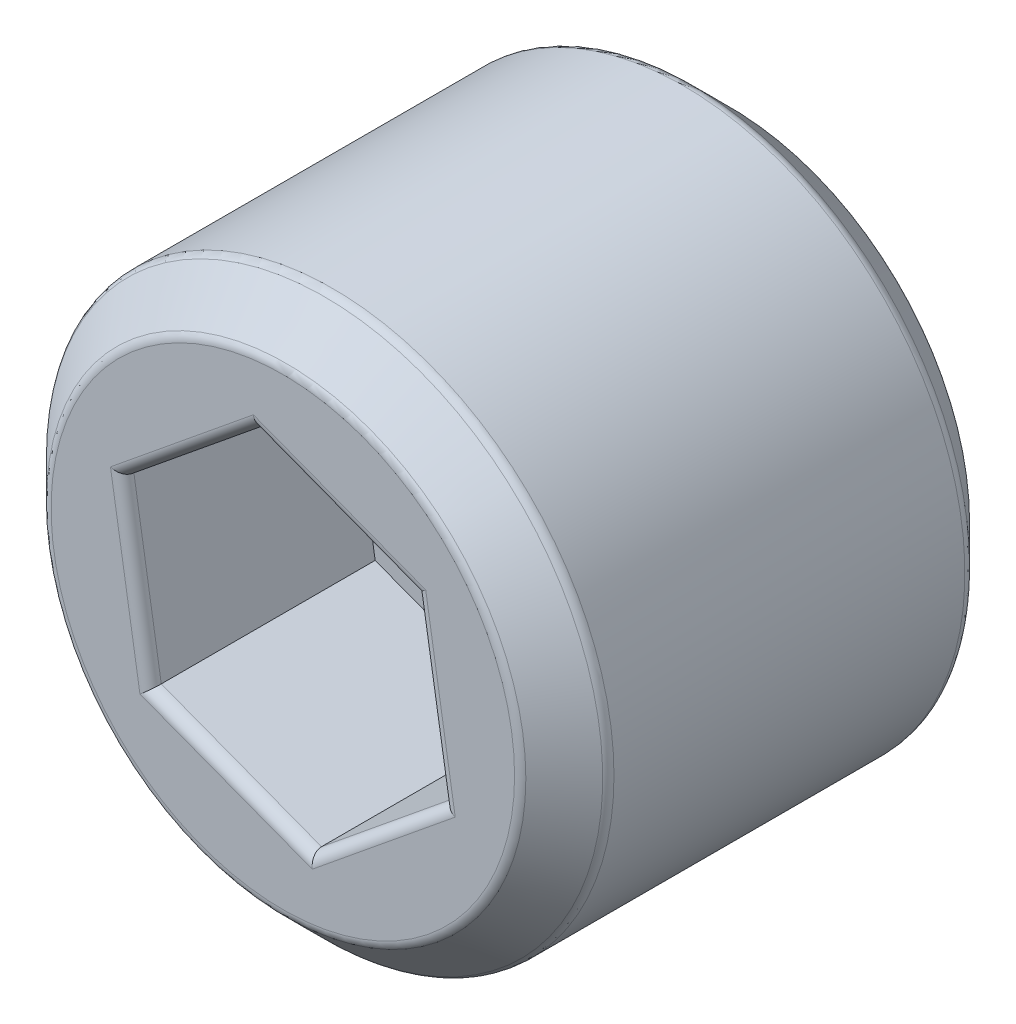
SolidWorks part; units mm, degrees
ref_plane "Plan1" through (0, 0, 0) normal (0, 0, 1) x (1, 0, 0)
ref_plane "Plan2" through (0, 0, 0) normal (0, 1, 0) x (1, 0, 0)
ref_plane "Plan3" through (0, 0, 0) normal (1, 0, 0) x (0, 0, -1)
sketch "Esquisse1" plane through (0, 0, 0) normal (0, 0, 1) x (1, 0, 0)
  circle A0 centre (0, 0) radius 2.5
  dimension "D1" = 5
extrude "Extrusion1" add sketch "Esquisse1" along normal blind 4
chamfer "Chanfrein1" distance 0.4 angle 45
sketch "Esquisse2" plane through (0, 0, 4) normal (0, 0, 1) x (1, 0, 0)
  line L1 (-0.2434, 1.5029) -> (-1.4233, 0.5406)
  line L2 (-1.4233, 0.5406) -> (-1.1798, -0.9623)
  line L3 (-1.1798, -0.9623) -> (0.2434, -1.5029)
  line L4 (0.2434, -1.5029) -> (1.4233, -0.5406)
  line L5 (1.4233, -0.5406) -> (1.1798, 0.9623)
  line L6 (1.1798, 0.9623) -> (-0.2434, 1.5029)
  circle A0 centre (0, 0) radius 1.3185 construction
extrude "Enlèv. mat.-Extru.1" cut sketch "Esquisse2" against normal blind 2
fillet "Congé1" radius 0.1
